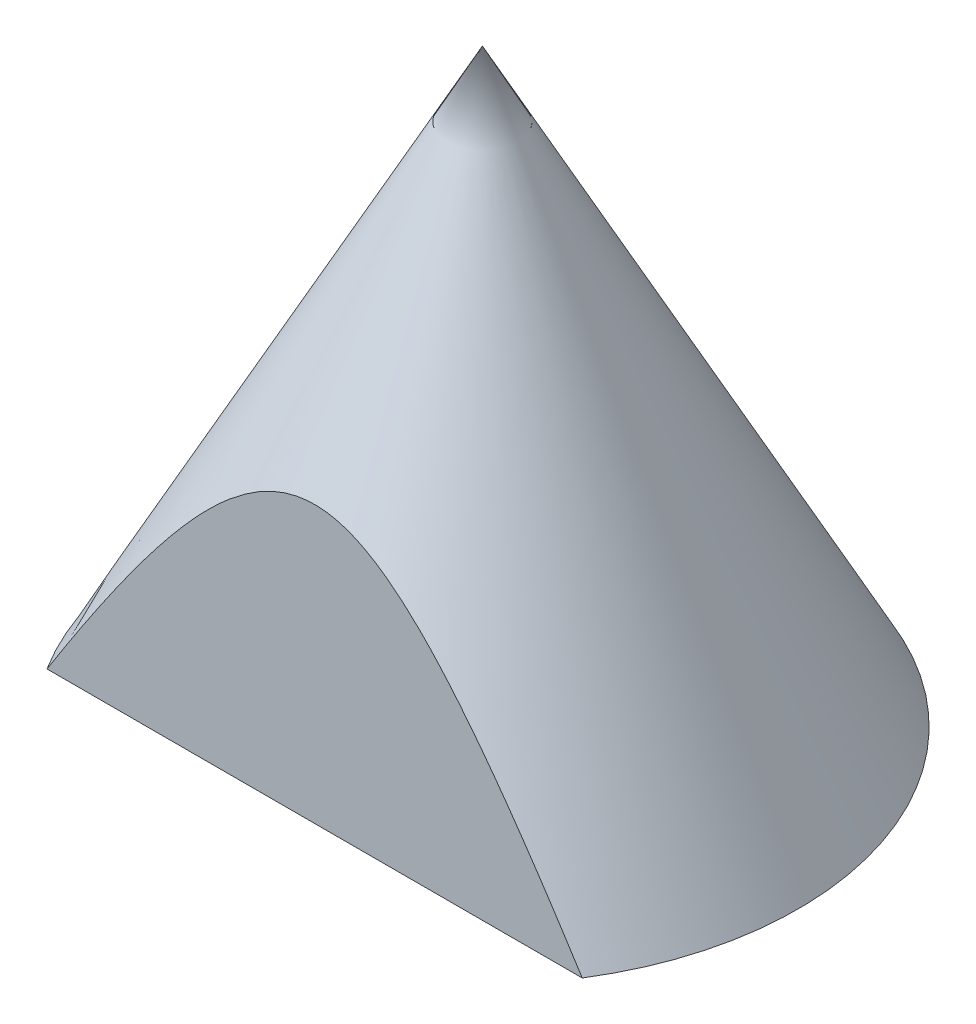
SolidWorks part; units mm, degrees
ref_plane "前视基准面" through (0, 0, 0) normal (0, 0, 1) x (1, 0, 0)
ref_plane "上视基准面" through (0, 0, 0) normal (0, 1, 0) x (1, 0, 0)
ref_plane "右视基准面" through (0, 0, 0) normal (1, 0, 0) x (0, 0, -1)
sketch "草图1" plane through (0, 0, 0) normal (0, 0, 1) x (1, 0, 0)
  line L0 (0, -13.5123) -> (0, 69.9373) construction
  line L1 (0, 59.8402) -> (-30.4001, 3.1182)
  line L2 (-30.4001, 3.1182) -> (0, 3.1182)
  line L3 (0, 3.1182) -> (0, 59.8402)
revolve "旋转1" add sketch "草图1" angle 360 about L0
sketch "草图2" plane through (0, 0, 0) normal (1, 0, 0) x (0, 0, -1)
  line L5 (0, 31.6199) -> (0, -1.2976) construction
  line L6 (-16.1482, 29.7102) -> (-16.1482, 3.1182)
  line L7 (-16.1482, 3.1182) -> (-33.0113, 3.1182)
  line L8 (-33.0113, 3.1182) -> (-16.1482, 29.7102)
extrude "切除-拉伸2" cut sketch "草图2" against normal mid plane 60
